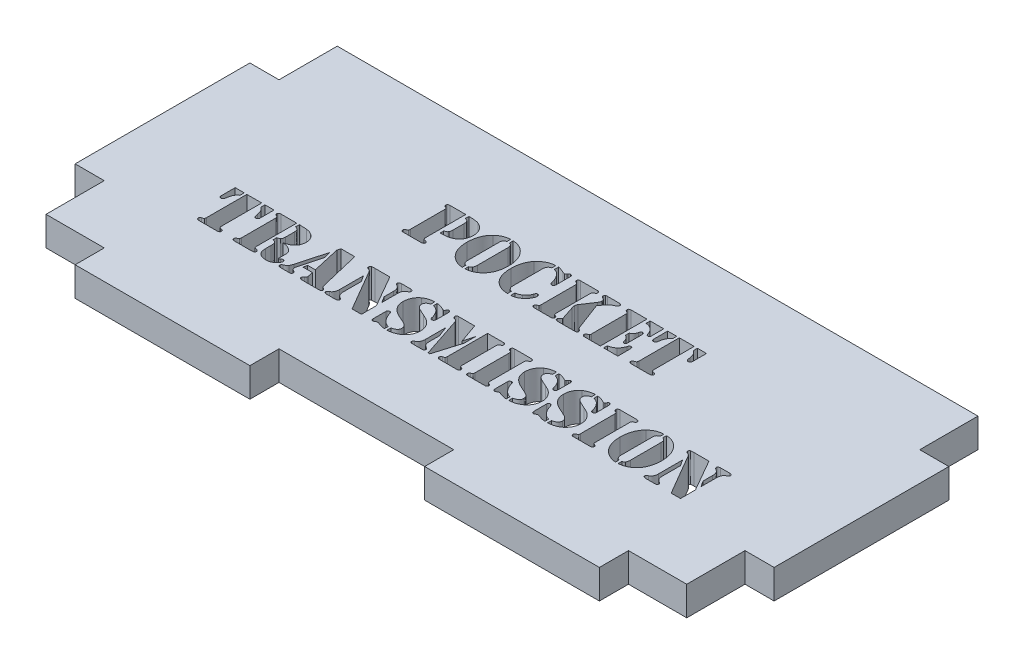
SolidWorks part; units mm, degrees
ref_plane "Front Plane" through (0, 0, 0) normal (0, 0, 1) x (1, 0, 0)
ref_plane "Top Plane" through (0, 0, 0) normal (0, 1, 0) x (1, 0, 0)
ref_plane "Right Plane" through (0, 0, 0) normal (1, 0, 0) x (0, 0, -1)
sketch "Sketch1" plane through (0, 0, 0) normal (0, 1, 0) x (1, 0, 0)
  line L0 (69.85, 0) -> (69.85, 31.75)
  line L1 (0, 0) -> (69.85, 0)
  line L2 (0, 0) -> (0, 31.75)
  line L3 (69.85, 31.75) -> (0, 31.75)
  dimension "D1" = 69.85
  dimension "D2" = 31.75
extrude "Boss-Extrude1" add sketch "Sketch1" along normal blind 3.175
sketch "Sketch2" plane through (0, 0, 0) normal (0, 1, 0) x (1, 0, 0)
  line L0 (69.85, 31.75) -> (0, 31.75) construction
  line L1 (63.5, 0) -> (63.5, -3.175)
  line L2 (63.5, -3.175) -> (44.45, -3.175)
  line L3 (44.45, 0) -> (44.45, -3.175)
  line L4 (63.5, 0) -> (44.45, 0)
  line L5 (34.925, 0) -> (34.925, 31.75) construction
  line L6 (0, 0) -> (69.85, 0) construction
  line L10 (0, 15.875) -> (69.85, 15.875) construction
  line L11 (0, 31.75) -> (0, 0) construction
  line L12 (69.85, 0) -> (69.85, 31.75) construction
  line L16 (6.35, 0) -> (6.35, -3.175)
  line L17 (6.35, -3.175) -> (25.4, -3.175)
  line L18 (25.4, 0) -> (25.4, -3.175)
  line L21 (6.35, 0) -> (25.4, 0)
  line L23 (0, 25.4) -> (-3.175, 25.4)
  line L24 (0, 25.4) -> (0, 6.35)
  line L25 (0, 6.35) -> (-3.175, 6.35)
  line L26 (-3.175, 25.4) -> (-3.175, 6.35)
  line L33 (73.025, 25.4) -> (73.025, 6.35)
  line L34 (69.85, 6.35) -> (73.025, 6.35)
  line L35 (69.85, 25.4) -> (69.85, 6.35)
  line L36 (69.85, 25.4) -> (73.025, 25.4)
  dimension "D1" = 19.05
  dimension "D2" = 3.175
  dimension "D3" = 6.35
  dimension "D4" = 19.05
  dimension "D5" = 3.175
  dimension "D6" = 6.35
  dimension "D7" = 6.35
  dimension "D8" = 19.05
  dimension "D9" = 3.175
extrude "Boss-Extrude2" add sketch "Sketch2" along normal blind 3.175
sketch "Sketch3" plane through (0, 3.175, 0) normal (0, 1, 0) x (1, 0, 0)
  line L0 (-3.175, 17.78) -> (73.025, 17.78) construction
  line L1 (25.4, 0) -> (44.45, 0) construction
  line L2 (-3.175, 25.4) -> (-3.175, 6.35) construction
  line L3 (73.025, 6.35) -> (73.025, 25.4) construction
  text T0 "Pocket  Transmission" font "Stencil" height 5.08
  dimension "D1" = 17.78
extrude "Cut-Extrude3" cut sketch "Sketch3" against normal up to next (3.175 mm away)
